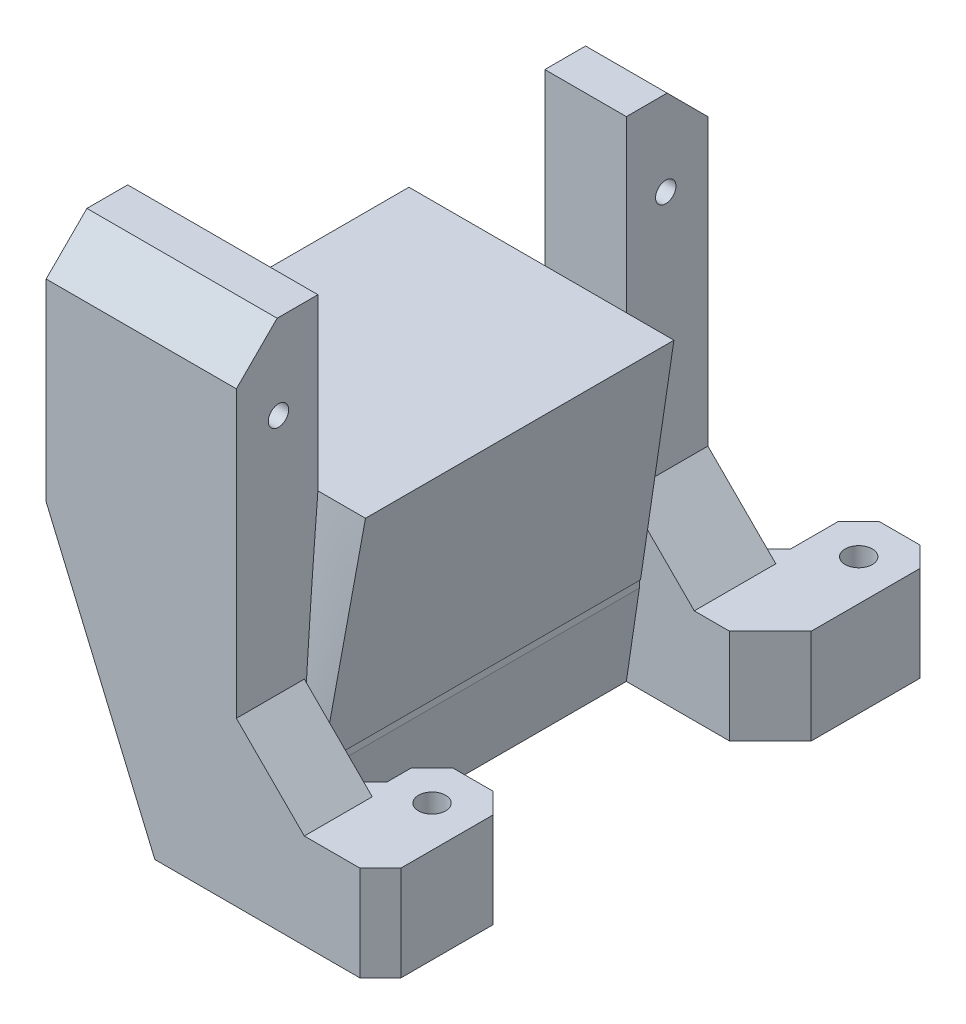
SolidWorks part; units mm, degrees
ref_plane "Front Plane" through (0, 0, 0) normal (0, 0, 1) x (1, 0, 0)
ref_plane "Top Plane" through (0, 0, 0) normal (0, 1, 0) x (1, 0, 0)
ref_plane "Right Plane" through (0, 0, 0) normal (1, 0, 0) x (0, 0, -1)
sketch "Sketch1" plane through (0, 0, 0) normal (1, 0, 0) x (0, 0, -1)
  line L0 (-17.35, 0) -> (-11.35, 0)
  line L1 (-11.35, 0) -> (-11.35, -12.5)
  line L2 (-9.35, -12.5) -> (9.35, -12.5)
  line L3 (11.35, -12.5) -> (11.35, 0)
  line L4 (11.35, 0) -> (17.35, 0)
  line L5 (17.35, 0) -> (17.35, -36)
  line L6 (17.35, -36) -> (-17.35, -36)
  line L7 (-17.35, -36) -> (-17.35, 0)
  line L8 (0, 14.2542) -> (0, -39.1319) construction
  line L9 (-9.45, -6.25) -> (49990.55, -6.25) construction
  line L10 (-14.25, -6.25) -> (-11.35, -6.25) construction
  line L11 (11.35, -6.25) -> (14.25, -6.25) construction
  line L12 (0, 18.75) -> (0, -40.2561) construction
  circle A0 centre (-14.25, -6.25) radius 0.75
  circle A1 centre (14.25, -6.25) radius 0.75
  circle A2 centre (0, -6.25) radius 25 construction
  arc A3 (-11.35, -12.5) -> (-9.35, -12.5) centre (-10.35, -12.5) ccw
  arc A4 (11.35, -12.5) -> (9.35, -12.5) centre (10.35, -12.5) cw
  point P11 (0, -4.15)
  point P18 (-11.35, -6.25)
  point P27 (0, -36)
  dimension "D4" = 1.5
  dimension "D5" = 50
  dimension "D7" = 1
  dimension "D9" = 28.5
  dimension "D1" = 2
  dimension "D2" = 12.5
  dimension "D3" = 6
  dimension "D6" = 23.5
  dimension "D8" = 22.7
  dimension "D10" = 2
extrude "Boss-Extrude1" add sketch "Sketch1" along normal blind 6
sketch "Sketch3" plane through (0, 0, 17.35) normal (0, 0, 1) x (1, 0, 0)
  line L0 (6, -36) -> (16, -36)
  line L2 (6, 0) -> (6, -36) construction
  line L3 (6, -24) -> (6, -36)
  line L4 (11, -29) -> (6, -24)
  line L5 (11, -29) -> (52, -29)
  line L6 (52, -29) -> (52, -36)
  line L7 (52, -36) -> (16, -36)
  dimension "D1" = 12
  dimension "D2" = 10
  dimension "D3" = 7
  dimension "D4" = 46
  dimension "D5" = 135
extrude "Boss-Extrude2" add sketch "Sketch3" against normal blind 5
sketch "Sketch4" plane through (0, 0, -17.35) normal (0, 0, -1) x (-1, 0, 0)
  line L0 (-6, -24) -> (-11, -29)
  line L1 (-11, -29) -> (-52, -29)
  line L2 (-52, -29) -> (-52, -36)
  line L4 (-52, -36) -> (-6, -36)
  line L5 (-6, -36) -> (-6, -24)
extrude "Boss-Extrude3" add sketch "Sketch4" against normal blind 6
sketch "Sketch5" plane through (0, -36, 0) normal (0, -1, 0) x (1, 0, 0)
  line L0 (52, 10.65) -> (52, -27.35) construction
  line L1 (0, 10.65) -> (0, -27.35) construction
  line L2 (0, -27.35) -> (52, -27.35)
  line L3 (52, 12.35) -> (52, 17.35) construction
  line L4 (52, 10.65) -> (0, 10.65) construction
  line L5 (0, 12.35) -> (52, 12.35) construction
  line L6 (7, 12.35) -> (7, 7.35)
  line L7 (26, -27.35) -> (26, -17.35) construction
  line L8 (52, -17.35) -> (0, -17.35) construction
  line L9 (47, 7.35) -> (0, 7.35) construction
  line L10 (0, 17.35) -> (52, 17.35) construction
  line L11 (0, 7.35) -> (0, 12.35) construction
  line L12 (0, -27.35) -> (0, -17.35)
  line L13 (0, -17.35) -> (52, -17.35)
  line L14 (52, -17.35) -> (52, -27.35)
  line L15 (52, 12.35) -> (52, -11.35)
  line L16 (52, -11.35) -> (47, -11.35)
  line L17 (52, -11.35) -> (6, -11.35) construction
  line L18 (47, -11.35) -> (47, 7.35)
  line L19 (7, 7.35) -> (47, 7.35)
  line L20 (7, 12.35) -> (52, 12.35)
  line L21 (6, 12.35) -> (6, -11.35) construction
  dimension "D1" = 1
  dimension "D2" = 38
  dimension "D3" = 5
  dimension "D4" = 10
  dimension "D5" = 5
extrude "Boss-Extrude4" add sketch "Sketch5" against normal up to surface (7 mm away)
sketch "Sketch6" plane through (0, -36, 0) normal (0, -1, 0) x (1, 0, 0)
  line L0 (13.6, 10.55) -> (13.6, 17.35) construction
  line L2 (52, 17.35) -> (0, 17.35) construction
  line L5 (0, 17.35) -> (0, -27.35) construction
  line L7 (45, -20.85) -> (52, -20.85) construction
  line L8 (52, -27.35) -> (52, 17.35) construction
  circle A0 centre (13.6, 10.55) radius 1
  circle A1 centre (45, 10.55) radius 1
  circle A2 centre (45, -20.85) radius 1
  circle A3 centre (13.6, -20.85) radius 1
  dimension "D1" = 2
  dimension "D2" = 31.4
  dimension "D3" = 31.4
  dimension "D4" = 6.8
  dimension "D5" = 7
extrude "Cut-Extrude1" cut sketch "Sketch6" against normal through all
sketch "Sketch7" plane through (0, -12.5, 0) normal (0, 1, 0) x (1, 0, 0)
  line L0 (6, 11.35) -> (9.5, 11.35)
  line L1 (9.5, 11.35) -> (9.5, -11.35)
  line L2 (9.5, -11.35) -> (6, -11.35)
  line L3 (6, -11.35) -> (6, 11.35) construction
  line L4 (0, 11.35) -> (-6, 11.35)
  line L5 (-10, 6.85) -> (-10, -11.35)
  line L6 (-10, -11.35) -> (0, -11.35)
  line L7 (0, -11.35) -> (0, 11.35) construction
  line L8 (0, 11.35) -> (6, 11.35)
  line L9 (0, -11.35) -> (6, -11.35)
  line L10 (-10, 6.85) -> (-6, 11.35) construction
  line L11 (-6, 11.35) -> (-10, 11.35)
  line L12 (-10, 11.35) -> (-10, 6.85)
  dimension "D1" = 3.5
  dimension "D2" = 10
  dimension "D3" = 4
  dimension "D4" = 4.5
sketch "Sketch8" plane through (0, -36, 0) normal (0, -1, 0) x (1, 0, 0)
  line L0 (0, 17.35) -> (0, -17.35)
  line L1 (0, -17.35) -> (6, -11.35)
  line L2 (6, -11.35) -> (6, 12.35)
  line L3 (6, 12.35) -> (0, 17.35)
sketch3d "3DSketch1"
  line L0 (-10, -12.5, 11.35) -> (0, -36, 17.35)
  line L1 (9.5, -12.5, 11.35) -> (6, -36, 12.35)
  line L2 (0, -36, -17.35) -> (-10, -12.5, -11.35)
  line L6 (9.5, -12.5, -11.35) -> (6, -36, -11.35)
sketch "Sketch12" plane through (0, 0, 0) normal (-1, 0, 0) x (0, 0, 1)
  line L0 (11.35, 0) -> (17.35, 0)
  line L1 (17.35, 0) -> (17.35, -36)
  line L2 (17.35, -36) -> (11.35, -36)
  line L3 (17.35, -36) -> (-27.35, -36) construction
  line L4 (11.35, -36) -> (11.35, 0)
  circle A0 centre (14.25, -6.25) radius 1
extrude "Boss-Extrude8" add sketch "Sketch12" along normal blind 8
loft "Loft1" add profiles "Sketch7", "Sketch8"
sketch "Sketch9" plane through (0, -29, 0) normal (0, 1, 0) x (1, 0, 0)
  line L0 (16.6, 27.35) -> (16.6, 14.35) construction
  line L1 (6.9574, 11.35) -> (6.9574, -12.35)
  line L2 (0, 27.35) -> (52, 27.35) construction
  line L3 (9.1, -12.35) -> (6.9574, -12.35)
  line L4 (10.6, -10.85) -> (9.1, -12.35)
  line L5 (52, -17.35) -> (11, -17.35) construction
  line L6 (15.1, -17.35) -> (52, -17.35)
  line L7 (52, -17.35) -> (52, 27.35)
  line L8 (11, -12.35) -> (7, -12.35) construction
  line L9 (52, 27.35) -> (16.6, 27.35)
  line L10 (0, 17.35) -> (9.1, 17.35)
  line L11 (10.6, 27.35) -> (10.6, -10.85) construction
  line L12 (0, 27.35) -> (52, 27.35) construction
  line L13 (12.1, 23.85) -> (15.1, 23.85)
  line L14 (11, 17.35) -> (0, 17.35) construction
  line L15 (12.1, 23.85) -> (10.6, 22.35)
  line L16 (15.1, 23.85) -> (16.6, 22.35)
  line L17 (9.1, 17.35) -> (10.6, 18.85)
  line L18 (10.6, -10.85) -> (10.6, -9.05)
  line L19 (6, 11.35) -> (7.5556, 11.35) construction
  line L20 (10.6, -9.05) -> (12.1, -7.55)
  line L21 (10.6, 18.85) -> (10.6, 22.35)
  line L22 (16.6, 14.35) -> (13.6, 11.35)
  line L23 (16.6, -15.85) -> (16.6, -9.05)
  line L24 (16.6, 14.35) -> (16.6, 22.35)
  line L25 (11, 11.35) -> (47, 11.35) construction
  line L26 (12.1, -7.55) -> (15.1, -7.55)
  line L27 (16.6, 27.35) -> (0, 27.35)
  line L28 (0, 27.35) -> (0, 17.35)
  line L29 (15.1, -7.55) -> (16.6, -9.05)
  line L30 (16.6, -15.85) -> (15.1, -17.35)
  line L31 (10.6, -12.35) -> (10.6, -17.35) construction
  line L33 (13.6, 11.35) -> (6.9574, 11.35)
  circle A1 centre (13.6, -10.55) radius 1 construction
  circle A3 centre (13.6, 20.85) radius 1 construction
  dimension "D4" = 3
  dimension "D2" = 3
  dimension "D1" = 3
  dimension "D3" = 3
  dimension "D8" = 1.5
  dimension "D11" = 3
  dimension "D13" = 3
  dimension "D5" = 135
  dimension "D6" = 1.5
  dimension "D7" = 135
  dimension "D9" = 135
  dimension "D10" = 1.5
  dimension "D12" = 135
  dimension "D14" = 1.5
  dimension "D15" = 1.5
extrude "Cut-Extrude2" cut sketch "Sketch9" against normal through all
sketch "Sketch10" plane through (6, 0, 0) normal (1, 0, 0) x (0, 0, -1)
  line L0 (-14.35, 0) -> (-17.35, -3)
  line L1 (-11.35, 0) -> (-17.35, 0) construction
  line L2 (-17.35, 0) -> (-17.35, -24) construction
  line L3 (14.35, 0) -> (17.35, -3)
  line L4 (17.35, 0) -> (11.35, 0) construction
  line L5 (17.35, -24) -> (17.35, 0) construction
  line L6 (-17.35, -3) -> (-17.35, 0)
  line L7 (-17.35, 0) -> (-14.35, 0)
  line L8 (14.35, 0) -> (17.35, 0)
  line L9 (17.35, 0) -> (17.35, -3)
  dimension "D1" = 45
extrude "Cut-Extrude3" cut sketch "Sketch10" against normal through all
sketch "Sketch15" plane through (0, 0, 11.35) normal (0, 0, -1) x (-1, 0, 0)
  line L0 (8, -17.2) -> (8, -36)
  line L1 (8, -36) -> (0, -36)
  line L2 (0, -36) -> (8, -17.2)
  line L3 (10, -12.5) -> (0, -36) construction
extrude "Cut-Extrude6" cut sketch "Sketch15" against normal through all
